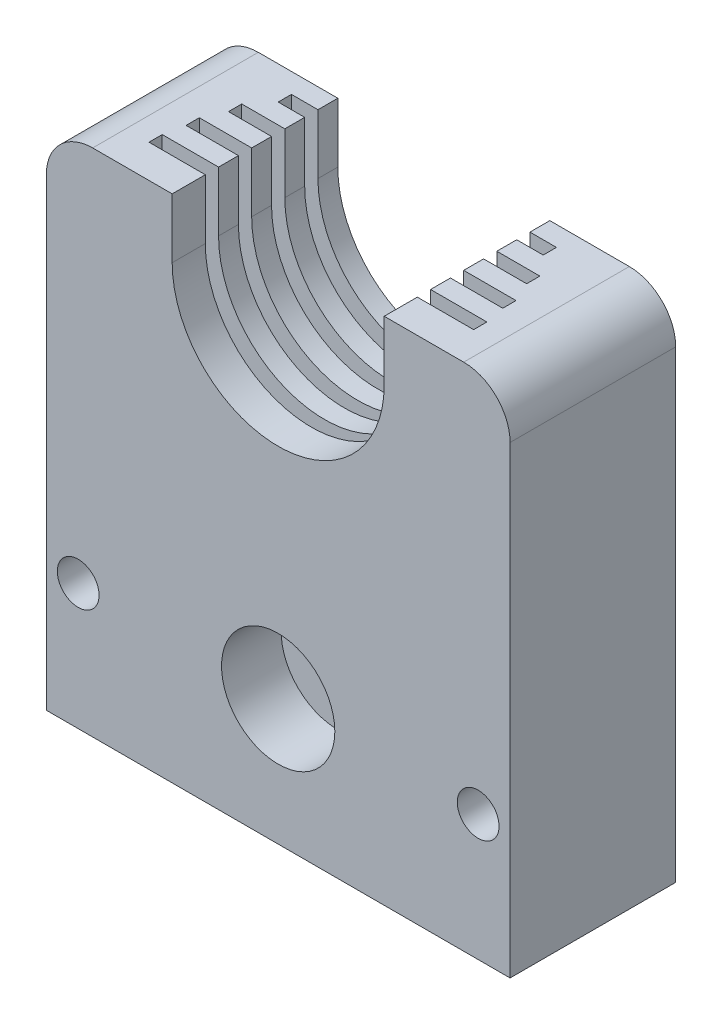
SolidWorks part; units mm, degrees
ref_plane "Front Plane" through (0, 0, 0) normal (0, 0, 1) x (1, 0, 0)
ref_plane "Top Plane" through (0, 0, 0) normal (0, 1, 0) x (1, 0, 0)
ref_plane "Right Plane" through (0, 0, 0) normal (1, 0, 0) x (0, 0, -1)
sketch "Sketch2" plane through (0, 0, 0) normal (0, 0, 1) x (1, 0, 0)
  line L1 (0, 70) -> (70, 70)
  line L2 (0, 70) -> (0, 0)
  line L3 (0, 0) -> (70, 0)
  line L4 (70, 70) -> (70, 0)
  dimension "D1" = 70
  dimension "D2" = 70
extrude "Boss-Extrude1" add sketch "Sketch2" along normal blind 25
fillet "Fillet1" radius 7 1 edges at (70, 70, 12.5)
fillet "Fillet2" radius 7 1 edges at (0, 70, 12.5)
sketch "Sketch4" plane through (0, 0, 25) normal (0, 0, 1) x (1, 0, 0)
  line L0 (0, 0) -> (70, 0) construction
  line L1 (0, 63) -> (0, 0) construction
  line L8 (4.815, 12) -> (65.185, 12) construction
  circle A0 centre (4.815, 12) radius 3.15
  circle A1 centre (65.185, 12) radius 3.15
  dimension "D1" = 6.3
  dimension "D4" = 6.3
  dimension "D2" = 12
  dimension "D3" = 4.815
  dimension "D5" = 60.37
sketch "Sketch6" plane through (0, 0, 25) normal (0, 0, 1) x (1, 0, 0)
  line L1 (7, 70) -> (63, 70) construction
  line L2 (19, 70) -> (51, 70) construction
  line L3 (19, 70) -> (19, 61)
  line L4 (51, 70) -> (51, 61)
  arc A0 (19, 61) -> (51, 61) centre (35, 61) ccw
  point P5 (35, 70)
  dimension "D1" = 9
extrude "Cut-Extrude3" cut sketch "Sketch6" against normal through all and the other way through all
extrude "Cut-Extrude11" cut sketch "Sketch4" against normal blind 20
sketch "Sketch20" plane through (0, 0, 25) normal (0, 0, 1) x (1, 0, 0)
  line L0 (4.815, 12) -> (65.185, 12) construction
  line L1 (0, 0) -> (70, 0) construction
  circle A0 centre (35, 12) radius 8.55
  dimension "D1" = 17.1
  dimension "D2" = 12
  dimension "D3" = 12
extrude "Cut-Extrude12" cut sketch "Sketch20" against normal blind 9
sketch "Sketch21" plane through (0, 0, 0) normal (0, -1, 0) x (1, 0, 0)
  line L1 (0, 25) -> (70, 25)
  line L2 (0, 25) -> (0, 0)
  line L3 (0, 0) -> (70, 0)
  line L4 (70, 25) -> (70, 0)
extrude "Boss-Extrude4" add sketch "Sketch21" along normal blind 7
sketch "Sketch23" plane through (0, 70, 0) normal (0, 1, 0) x (1, 0, 0)
  line L0 (35, -25) -> (35, 0)
  line L1 (19, -25) -> (51, -25) construction
  line L2 (51, 0) -> (19, 0) construction
  line L3 (19, -25) -> (7, -25) construction
  line L4 (11.1, -15) -> (58.9, -15)
  line L5 (11.1, -15) -> (11.1, -13)
  line L6 (11.1, -13) -> (58.9, -13)
  line L7 (58.9, -15) -> (58.9, -13)
  line L8 (11.1, -15) -> (58.9, -13) construction
  line L9 (11.1, -13) -> (58.9, -15) construction
  line L10 (10.5, -20) -> (59.5, -20)
  line L11 (10.5, -20) -> (10.5, -18)
  line L12 (10.5, -18) -> (59.5, -18)
  line L13 (59.5, -20) -> (59.5, -18)
  line L14 (10.5, -20) -> (59.5, -18) construction
  line L15 (10.5, -18) -> (59.5, -20) construction
  line L16 (12.5, -10) -> (57.5, -10)
  line L17 (12.5, -10) -> (12.5, -8)
  line L18 (12.5, -8) -> (57.5, -8)
  line L19 (57.5, -10) -> (57.5, -8)
  line L20 (12.5, -10) -> (57.5, -8) construction
  line L21 (12.5, -8) -> (57.5, -10) construction
  line L22 (15, -5) -> (55, -5)
  line L23 (15, -5) -> (15, -3)
  line L24 (15, -3) -> (55, -3)
  line L25 (55, -5) -> (55, -3)
  line L26 (15, -5) -> (55, -3) construction
  line L27 (15, -3) -> (55, -5) construction
  point P6 (35, -14)
  point P11 (35, -19)
  point P16 (35, -9)
  point P21 (35, -4)
  point P28 (0, 0)
  point P29 (0, 0)
  dimension "D1" = 5
  dimension "D2" = 2
  dimension "D3" = 3
  dimension "D4" = 2
  dimension "D5" = 3
  dimension "D6" = 2
  dimension "D7" = 3
  dimension "D8" = 2
  dimension "D9" = 40
  dimension "D10" = 45
  dimension "D11" = 47.8
  dimension "D12" = 49
extrude "Cut-Extrude13" cut sketch "Sketch23" against normal blind 27 contours L24 L22 L0 M18 | L16 L19 L18 L0 | L18 L17 L16 M18 | L18 L16 L0 M18 | L6 L5 L4 M18 | L6 L4 L0 M18 | L4 L7 L6 L0 | L10 L13 L12 L0 | L12 L11 L10 M18 | L12 L10 L0 M18
